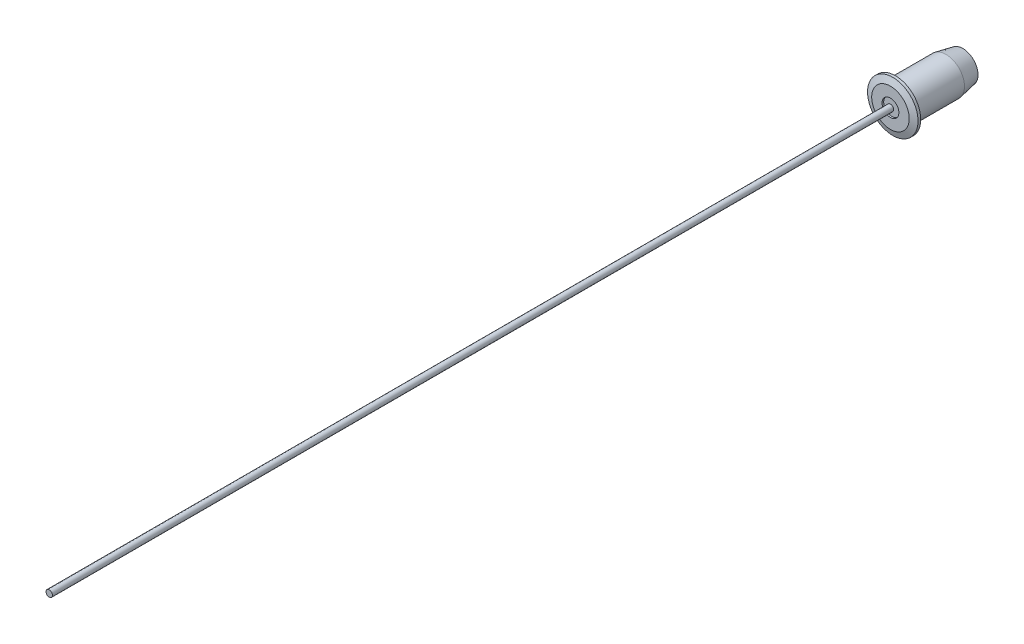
SolidWorks part; units mm, degrees
ref_plane "Front Plane" through (0, 0, 0) normal (0, 0, 1) x (1, 0, 0)
ref_plane "Top Plane" through (0, 0, 0) normal (0, 1, 0) x (1, 0, 0)
ref_plane "Right Plane" through (0, 0, 0) normal (1, 0, 0) x (0, 0, -1)
sketch "Sketch1" plane through (0, 0, 0) normal (0, 0, 1) x (1, 0, 0)
  circle A0 centre (0, 0) radius 7.5
  dimension "D1" = 15
extrude "Boss-Extrude1" add sketch "Sketch1" along normal blind 1.5
chamfer "Chamfer2" distance 0.7 angle 70 1 edges at (7.5, 0, 1.5)
sketch "Sketch2" plane through (0, 0, 0) normal (0, 0, -1) x (-1, 0, 0)
  circle A0 centre (0, 0) radius 5.5
  dimension "D1" = 11
extrude "Boss-Extrude2" add sketch "Sketch2" along normal blind 20
chamfer "Chamfer3" distance 5 angle 11 1 edges at (-5.5, 0, -20)
sketch "Sketch3" plane through (0, 0, 1.5) normal (0, 0, 1) x (1, 0, 0)
  circle A0 centre (0, 0) radius 2.5
  dimension "D1" = 5
extrude "Cut-Extrude1" cut sketch "Sketch3" against normal blind 0.5
sketch "Sketch4" plane through (0, 0, 1.5) normal (0, 0, 1) x (1, 0, 0)
  circle A0 centre (0, 0) radius 0.25
  dimension "D1" = 0.5
extrude "Boss-Extrude3" [suppressed] add sketch "Sketch4" along normal blind 500 separate body
sketch "Sketch5" plane through (0, 0, 1.5) normal (0, 0, 1) x (1, 0, 0)
  circle A0 centre (0, 0) radius 0.9547
extrude "Boss-Extrude4" add sketch "Sketch5" along normal blind 250 separate body
